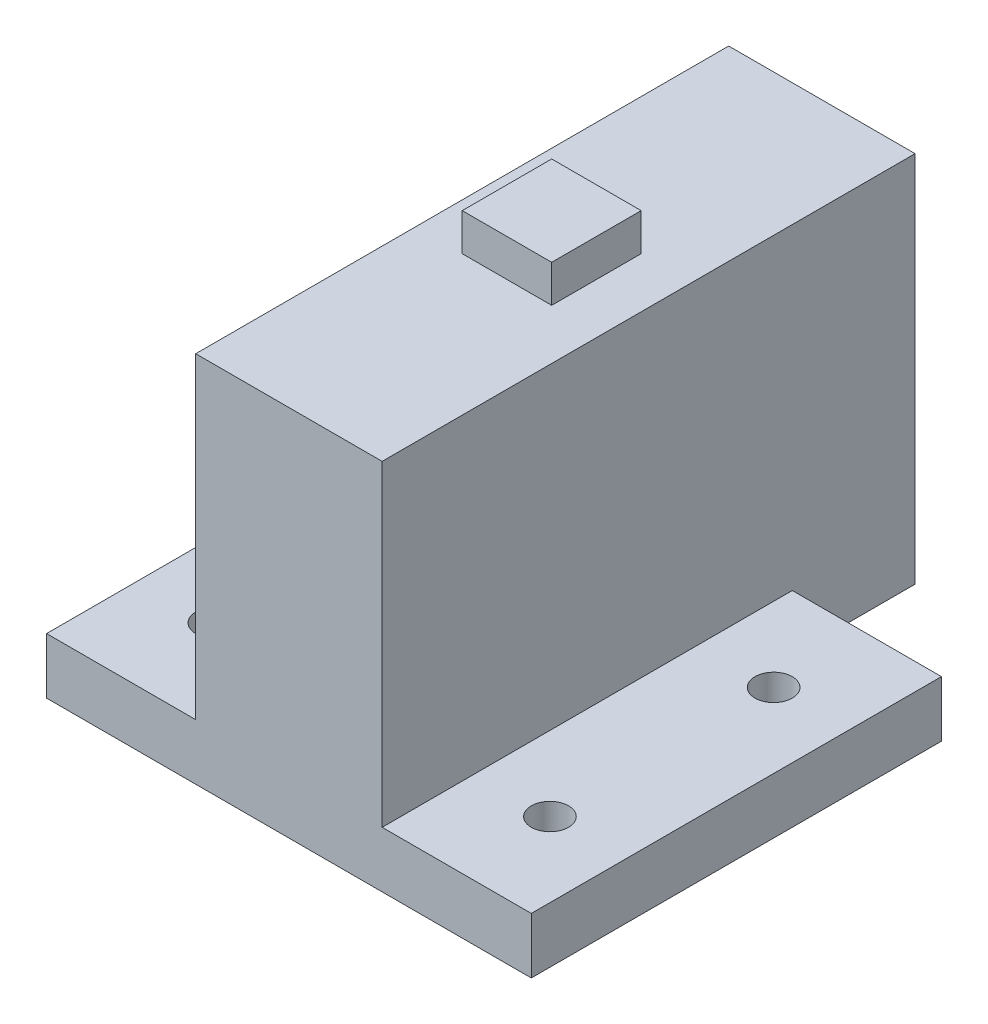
SolidWorks part; units mm, degrees
ref_plane "Front Plane" through (0, 0, 0) normal (0, 0, 1) x (1, 0, 0)
ref_plane "Top Plane" through (0, 0, 0) normal (0, 1, 0) x (1, 0, 0)
ref_plane "Right Plane" through (0, 0, 0) normal (1, 0, 0) x (0, 0, -1)
sketch "Sketch1" plane through (0, 0, 0) normal (0, 1, 0) x (1, 0, 0)
  line L2 (-20, 0) -> (-20, 150)
  line L4 (-20, 150) -> (30, 150)
  line L6 (-20, 0) -> (30, 0)
  line L7 (30, 150) -> (30, 0)
  dimension "D2" = 150
extrude "Boss-Extrude1" add sketch "Sketch1" along normal blind 250
sketch "Sketch2" plane through (30, 0, 0) normal (1, 0, 0) x (0, 0, -1)
  line L0 (75, 250) -> (75, 175) construction
  line L1 (0, 250) -> (150, 250) construction
  circle A0 centre (75, 175) radius 52.5
  dimension "D2" = 105
  dimension "D1" = 75
extrude "Cut-Extrude1" cut sketch "Sketch2" against normal blind 15 contours A0
sketch "Sketch4" plane through (0, 0, 0) normal (0, 0, 1) x (1, 0, 0)
  line L0 (30, 0) -> (30, 125) construction
  line L1 (30, 0) -> (30, 62.5)
  line L2 (30, 250) -> (30, 0) construction
  line L3 (30, 62.5) -> (-20, 62.5) construction
  line L4 (30, 0) -> (101.0377, 0)
  line L5 (-20, 250) -> (-20, 0) construction
  line L6 (-20, 0) -> (-91, 0)
  line L7 (-20, 0) -> (-20, 62.5)
  arc A0 (101.0377, 0) -> (30, 62.5) centre (101.0377, 71.6208) cw
  arc A1 (-91, 0) -> (-20, 62.5) centre (-91, 71.578) ccw
  dimension "D1" = 71.6208
  dimension "D2" = 71
extrude "Boss-Extrude2" add sketch "Sketch4" against normal up to vertex (150 mm away)
sketch "Sketch8" plane through (0, 0, -150) normal (0, 0, -1) x (-1, 0, 0)
  line L0 (-30, 250) -> (-30, 62.5)
  line L2 (20, 62.5) -> (20, 250)
  line L3 (20, 250) -> (-30, 250)
  line L4 (-101.0377, 0) -> (91, 0)
  arc A0 (-101.0377, 0) -> (-30, 62.5) centre (-101.0377, 71.6208) ccw
  arc A1 (91, 0) -> (20, 62.5) centre (91, 71.578) cw
extrude "Boss-Extrude3" add sketch "Sketch8" along normal blind 175
sketch "Sketch10" plane through (30, 0, 0) normal (1, 0, 0) x (0, 0, -1)
  line L0 (325, 250) -> (275.0118, 250)
  line L1 (0, 250) -> (325, 250) construction
  line L2 (275.0118, 250) -> (275.0118, 0)
  line L3 (325, 0) -> (0, 0) construction
  line L4 (275.0118, 0) -> (325, 0)
  line L5 (325, 0) -> (325, 250)
  dimension "D1" = 250
  dimension "D2" = 49.9882
extrude "Boss-Extrude4" add sketch "Sketch10" along normal blind 200
sketch "Sketch11" plane through (0, 0, -325) normal (0, 0, -1) x (-1, 0, 0)
  line L0 (-230, 0) -> (-230, 175) construction
  line L2 (-230, 0) -> (-230, 250) construction
  line L3 (-166.5, 175) -> (-135.5, 175)
  line L4 (-166.5, 175) -> (-197.5, 175)
  line L5 (-197.5, 175) -> (-197.5, 154)
  line L6 (-197.5, 154) -> (-135.5, 154)
  line L8 (-135.5, 154) -> (-135.5, 175)
  dimension "D1" = 175
  dimension "D2" = 31
  dimension "D3" = 31
  dimension "D4" = 63.5
  dimension "D5" = 175
  dimension "D6" = 21
extrude "Cut-Extrude4" cut sketch "Sketch11" against normal through all
sketch "Sketch12" plane through (0, 250, 0) normal (0, 1, 0) x (1, 0, 0)
  line L0 (30, 275.0118) -> (30, 325)
  line L1 (-20, 325) -> (230, 325) construction
  line L2 (30, 325) -> (230, 325)
  line L3 (230, 325) -> (230, 275.0118)
  line L4 (230, 275.0118) -> (30, 275.0118)
extrude "Cut-Extrude5" cut sketch "Sketch12" against normal blind 55
sketch "Sketch16" plane through (15, 0, 0) normal (1, 0, 0) x (0, 0, -1)
  line L0 (71.75, 180) -> (78.25, 180)
  line L2 (71.75, 170) -> (78.25, 170)
  spline S0 degree 2 poles (78.25, 170) (84.2851, 175) (78.25, 180) knots 0 0 0 1 1 1
  spline S1 degree 2 poles (71.75, 180) (66.058, 175) (71.75, 170) knots 0 0 0 1 1 1
  point P17 (75, 175)
  point P18 (75, 175)
  dimension "D1" = 6.5
  dimension "D2" = 6.5
  dimension "D3" = 10
extrude "Cut-Extrude8" cut sketch "Sketch16" against normal blind 20
sketch "Sketch17" plane through (15, 0, 0) normal (1, 0, 0) x (0, 0, -1)
  line L1 (81.3183, 180.25) -> (81.3183, 169.75)
  line L3 (68.8183, 169.75) -> (68.8183, 180.25)
  line L4 (68.8183, 169.75) -> (81.3183, 169.75)
  line L5 (68.8183, 180.25) -> (81.3183, 180.25)
  line L6 (78.25, 180) -> (71.75, 180) construction
  point P35 (69.975, 175)
  dimension "D2" = 10.5
  dimension "D3" = 12.5
  dimension "D4" = 0.25
extrude "Cut-Extrude9" cut sketch "Sketch17" against normal blind 9 contours L5 L3 L4 M3 | L5 L4 L1 M5
sketch "Sketch20" plane through (30, 0, 0) normal (1, 0, 0) x (0, 0, -1)
  circle A2 centre (75, 175) radius 54.5
  circle A3 centre (75, 175) radius 54.5
  dimension "D1" = 2
extrude "Cut-Extrude10" cut sketch "Sketch20" against normal blind 10
sketch "Sketch21" plane through (30, 0, 0) normal (1, 0, 0) x (0, 0, -1)
  line L0 (142.9431, 250) -> (142.9431, 195)
  line L1 (0, 250) -> (325, 250) construction
  line L2 (142.9431, 195) -> (325, 195)
  line L3 (325, 195) -> (325, 250) construction
  line L4 (325, 195) -> (325, 250)
  line L5 (142.9431, 250) -> (325, 250)
extrude "Cut-Extrude11" cut sketch "Sketch21" against normal through all
sketch "Sketch24" plane through (0, 0, -275.0118) normal (0, 0, 1) x (1, 0, 0)
  line L0 (158.25, 154) -> (158.25, 137.5)
  line L1 (158.25, 154) -> (174.75, 154)
  line L2 (174.75, 154) -> (174.75, 137.5)
  line L3 (174.75, 137.5) -> (158.25, 137.5)
  line L4 (197.5, 154) -> (135.5, 154) construction
  point P1 (166.5, 154)
  dimension "D1" = 16.5
  dimension "D2" = 16.5
  dimension "D3" = 8.25
  dimension "D4" = 0
extrude "Cut-Extrude13" cut sketch "Sketch24" against normal blind 50
sketch "Sketch25" plane through (0, 0, -275.0118) normal (0, 0, 1) x (1, 0, 0)
  line L0 (158.25, 131.1863) -> (174.75, 131.1863)
  line L1 (174.75, 131.1863) -> (174.75, 109.1863)
  line L2 (174.75, 109.1863) -> (158.25, 109.1863)
  line L3 (158.25, 109.1863) -> (158.25, 131.1863)
  line L4 (174.75, 137.5) -> (174.75, 154) construction
  line L5 (158.25, 137.5) -> (158.25, 86.1961) construction
  dimension "D1" = 0
  dimension "D2" = 0
  dimension "D3" = 22
extrude "Cut-Extrude14" cut sketch "Sketch25" against normal blind 50
sketch "Sketch26" plane through (0, 0, -275.0118) normal (0, 0, 1) x (1, 0, 0)
  line L0 (158.25, 137.5) -> (158.25, 131.1863)
  line L1 (174.75, 131.1863) -> (158.25, 131.1863) construction
  line L2 (158.25, 131.1863) -> (174.75, 131.1863)
  line L3 (174.75, 131.1863) -> (174.75, 137.5)
  line L4 (174.75, 137.5) -> (158.25, 137.5)
extrude "Cut-Extrude15" cut sketch "Sketch26" against normal blind 50
sketch "Sketch27" plane through (230, 0, 0) normal (1, 0, 0) x (0, 0, -1)
  line L0 (291.5012, 135.1004) -> (298.0012, 135.1004)
  line L2 (291.5012, 125.1004) -> (298.0012, 125.1004)
  spline S0 degree 2 poles (298.0012, 125.1004) (303.3445, 130.2078) (298.0012, 135.1004) knots 0 0 0 1 1 1
  spline S1 degree 2 poles (291.5012, 135.1004) (285.4561, 130.2078) (291.5012, 125.1004) knots 0 0 0 1 1 1
  point P5 (294.7512, 109.4204)
  point P17 (294.7512, 115.4204)
  point P18 (294.7512, 115.4204)
  dimension "D1" = 6.5
  dimension "D2" = 6.5
  dimension "D3" = 10
  dimension "D4" = 15.68
extrude "Cut-Extrude16" cut sketch "Sketch27" against normal blind 29 from offset 71.75
sketch "Sketch29" plane through (158.25, 0, 0) normal (1, 0, 0) x (0, 0, -1)
  line L0 (298.0012, 135.1004) -> (291.5012, 135.1004) construction
  line L1 (291.5012, 125.1004) -> (298.0012, 125.1004) construction
  line L2 (298.0012, 135.1004) -> (291.5012, 135.1004)
  line L3 (291.5012, 125.1004) -> (298.0012, 125.1004)
  line L4 (300.8323, 135.3999) -> (300.8323, 124.8999)
  line L5 (288.3323, 124.8999) -> (288.3323, 135.3999)
  line L6 (288.3323, 124.8999) -> (300.8323, 124.8999)
  line L7 (288.3323, 135.3999) -> (300.8323, 135.3999)
  parabola Q0 construction
  parabola Q1 construction
  parabola Q2
  parabola Q3
  dimension "D1" = 12.5
  dimension "D2" = 10.5
extrude "Cut-Extrude18" cut sketch "Sketch29" against normal blind 9
sketch "Sketch30" plane through (0, 0, -275.0118) normal (0, 0, 1) x (1, 0, 0)
  line L0 (158.25, 135.3999) -> (158.25, 124.8999) construction
  line L1 (158.25, 142.0296) -> (158.25, 109.1753)
  line L2 (158.25, 142.0296) -> (198.9228, 142.0296)
  line L3 (198.9228, 142.0296) -> (198.9228, 109.1753)
  line L4 (198.9228, 109.1753) -> (158.25, 109.1753)
extrude "Cut-Extrude19" cut sketch "Sketch30" against normal blind 50
sketch "Sketch31" plane through (-5, 0, 0) normal (1, 0, 0) x (0, 0, -1)
  circle A0 centre (74.9505, 175.0712) radius 3.5
  dimension "D1" = 7
extrude "Cut-Extrude20" cut sketch "Sketch31" against normal blind 20
sketch "Sketch32" plane through (0, 0, -325) normal (0, 0, -1) x (-1, 0, 0)
  line L4 (-129.25, 135.1004) -> (-149.25, 135.1004)
  line L5 (-149.25, 135.1004) -> (-149.25, 125.1004)
  line L6 (-149.25, 125.1004) -> (-129.25, 125.1004)
  line L7 (-129.25, 125.1004) -> (-129.25, 135.1004)
  line L8 (-129.25, 135.1004) -> (-149.25, 135.1004)
  line L9 (-149.25, 135.1004) -> (-149.25, 125.1004)
  line L10 (-149.25, 125.1004) -> (-129.25, 125.1004)
  line L11 (-129.25, 125.1004) -> (-129.25, 135.1004)
  circle A0 centre (-131.6164, 129.9902) radius 3.5
  dimension "D2" = 7
  dimension "D1" = 0
extrude "Cut-Extrude21" cut sketch "Sketch32" against normal blind 33 contours L11 A0
sketch "Sketch33" plane through (30, 0, 0) normal (1, 0, 0) x (0, 0, -1)
  circle A0 centre (74.9505, 175.0712) radius 60
  circle A1 centre (74.9505, 175.0712) radius 63
  dimension "D1" = 120
  dimension "D2" = 126
extrude "Cut-Extrude22" cut sketch "Sketch33" against normal blind 20
sketch "Sketch34" plane through (0, 195, 0) normal (0, 1, 0) x (1, 0, 0)
  line L0 (-91, 325) -> (230, 325)
  line L1 (230, 325) -> (230, 235)
  line L2 (230, 235) -> (-91, 235)
  line L3 (-91, 325) -> (-91, 0) construction
  line L4 (-91, 235) -> (-91, 325)
  dimension "D1" = 90
extrude "Cut-Extrude23" cut sketch "Sketch34" against normal blind 300
sketch "Sketch35" plane through (0, 250, 0) normal (0, 1, 0) x (1, 0, 0)
  line L0 (-91, 0) -> (-20, 0)
  line L1 (-20, 0) -> (-20, 235)
  line L2 (-20, 235) -> (-91, 235)
  line L3 (-91, 235) -> (-91, 0)
  line L4 (30, 0) -> (101.0377, 0)
  line L5 (101.0377, 0) -> (101.0377, 235)
  line L6 (101.0377, 235) -> (30, 235)
  line L7 (30, 235) -> (30, 0)
extrude "Cut-Extrude24" cut sketch "Sketch35" against normal through all both
sketch "Sketch36" plane through (0, 195, 0) normal (0, 1, 0) x (1, 0, 0)
  line L0 (30, 235) -> (80, 235)
  line L1 (80, 235) -> (80, 190)
  line L2 (80, 190) -> (30, 190)
  line L3 (30, 142.9431) -> (30, 235) construction
  line L4 (30, 190) -> (30, 235)
  dimension "D1" = 50
  dimension "D2" = 45
extrude "Boss-Extrude5" add sketch "Sketch36" against normal blind 40 from offset 155
sketch "Sketch38" plane through (30, 0, 0) normal (1, 0, 0) x (0, 0, -1)
  line L0 (0, 0) -> (0, 15)
  line L1 (0, 250) -> (0, 0) construction
  line L2 (0, 15) -> (110, 15)
  line L3 (110, 15) -> (110, 0)
  line L5 (110, 0) -> (0, 0)
  dimension "D1" = 110
  dimension "D2" = 110
  dimension "D3" = 15
extrude "Boss-Extrude6" add sketch "Sketch38" along normal blind 40
sketch "Sketch39" plane through (-20, 0, 0) normal (-1, 0, 0) x (0, 0, 1)
  line L0 (-110, 0) -> (-110, 15)
  line L1 (0, 0) -> (-235, 0) construction
  line L2 (-110, 15) -> (0, 15)
  line L3 (0, 250) -> (0, 0) construction
  line L4 (0, 15) -> (0, 0)
  line L5 (0, 0) -> (-110, 0)
  dimension "D1" = 110
  dimension "D2" = 15
extrude "Boss-Extrude7" add sketch "Sketch39" along normal blind 40
sketch "Sketch40" plane through (0, 15, 0) normal (0, 1, 0) x (1, 0, 0)
  line L0 (70, 0) -> (30, 0) construction
  line L1 (-60, 0) -> (-20, 0) construction
  line L2 (-60, 0) -> (-60, 110) construction
  line L3 (70, 110) -> (70, 0) construction
  circle A0 centre (-40, 85) radius 5
  circle A1 centre (-40, 25) radius 5
  circle A2 centre (50, 85) radius 5
  circle A3 centre (50, 25) radius 5
  dimension "D1" = 10
  dimension "D2" = 10
  dimension "D3" = 10
  dimension "D4" = 10
  dimension "D5" = 60
  dimension "D6" = 25
  dimension "D7" = 60
  dimension "D8" = 25
  dimension "D9" = 20
  dimension "D10" = 20
extrude "Cut-Extrude25" cut sketch "Sketch40" against normal through all both
sketch "Sketch41" plane through (0, 0, -235) normal (0, 0, -1) x (-1, 0, 0)
  line L0 (-15.075, 162.075) -> (-15.075, 141.925)
  line L1 (-15.075, 141.925) -> (5.075, 141.925)
  line L2 (5.075, 141.925) -> (5.075, 162.075)
  line L3 (5.075, 162.075) -> (-15.075, 162.075)
  line L4 (-15.075, 109.075) -> (-15.075, 88.925)
  line L5 (-15.075, 88.925) -> (5.075, 88.925)
  line L6 (5.075, 88.925) -> (5.075, 109.075)
  line L7 (5.075, 109.075) -> (-15.075, 109.075)
  line L8 (-15.075, 56.075) -> (-15.075, 35.925)
  line L9 (-15.075, 35.925) -> (5.075, 35.925)
  line L10 (5.075, 35.925) -> (5.075, 56.075)
  line L11 (5.075, 56.075) -> (-15.075, 56.075)
  line L12 (-62.075, 30.075) -> (-62.075, 9.925)
  line L13 (-62.075, 9.925) -> (-41.925, 9.925)
  line L14 (-41.925, 9.925) -> (-41.925, 30.075)
  line L15 (-41.925, 30.075) -> (-62.075, 30.075)
  line L16 (-15.075, 162.075) -> (5.075, 141.925) construction
  line L17 (5.075, 162.075) -> (-15.075, 141.925) construction
  line L18 (-15.075, 109.075) -> (5.075, 88.925) construction
  line L19 (5.075, 109.075) -> (-15.075, 88.925) construction
  line L20 (-15.075, 56.075) -> (5.075, 35.925) construction
  line L21 (5.075, 56.075) -> (-15.075, 35.925) construction
  line L22 (-62.075, 30.075) -> (-41.925, 9.925) construction
  line L23 (-41.925, 30.075) -> (-62.075, 9.925) construction
  line L24 (20, 195) -> (-30, 195) construction
  line L25 (-80, 0) -> (-80, 40) construction
  line L26 (-80, 40) -> (-30, 40) construction
  line L27 (-30, 40) -> (-30, 195) construction
  point P16 (-52, 20)
  point P17 (-5, 46)
  point P18 (-5, 99)
  point P19 (-5, 152)
  dimension "D1" = 20.15
  dimension "D2" = 20.15
  dimension "D3" = 20.15
  dimension "D4" = 20.15
  dimension "D5" = 20.15
  dimension "D6" = 20.15
  dimension "D7" = 20.15
  dimension "D8" = 20.15
  dimension "D9" = 43
  dimension "D10" = 96
  dimension "D11" = 149
  dimension "D12" = 28
  dimension "D13" = 20
  dimension "D14" = 25
  dimension "D15" = 25
  dimension "D16" = 25
extrude "Cut-Extrude26" cut sketch "Sketch41" against normal blind 31.5
sketch "Sketch43" plane through (30, 0, 0) normal (1, 0, 0) x (0, 0, -1)
  line L1 (142.9431, 195) -> (235, 195)
  line L2 (142.9431, 195) -> (142.9431, 0)
  line L3 (142.9431, 0) -> (235, 0)
  line L4 (235, 195) -> (235, 0)
extrude "Cut-Extrude27" cut sketch "Sketch43" against normal blind 70 and the other way blind 75 contours L2 L1 L4 L3
sketch "Sketch44" plane through (30, 0, 0) normal (1, 0, 0) x (0, 0, -1)
  line L0 (0, 250) -> (0, 15) construction
  line L6 (142.9431, 100) -> (0, 100)
  line L7 (142.9431, 100) -> (142.9431, 250)
  line L8 (142.9431, 250) -> (0, 250)
  line L9 (0, 100) -> (0, 250)
extrude "Cut-Extrude28" cut sketch "Sketch44" against normal blind 62 and the other way blind 41
sketch "Sketch45" plane through (0, 100, 0) normal (0, 1, 0) x (1, 0, 0)
  line L4 (-7.5, 58.9716) -> (16.5, 58.9716)
  line L5 (-7.5, 58.9716) -> (-7.5, 82.9716)
  line L6 (-7.5, 82.9716) -> (16.5, 82.9716)
  line L7 (16.5, 58.9716) -> (16.5, 82.9716)
  line L8 (-7.5, 58.9716) -> (5, 71.4731) construction
  line L9 (5, 71.4731) -> (16.5, 58.9716) construction
  line L12 (30, 142.9431) -> (-20, 142.9431) construction
  line L13 (30, 0) -> (30, 142.9431) construction
  line L14 (-20, 142.9431) -> (-20, 0) construction
  line L16 (30, 0) -> (-20, 0) construction
  line L17 (30, 110) -> (30, 0) construction
  point P4 (0, 0)
  point P6 (0.1269, 88.3244)
  dimension "D1" = 24
  dimension "D2" = 24
  dimension "D3" = 71.47
  dimension "D4" = 25
  dimension "D5" = 25
  dimension "D6" = 58.9716
  dimension "D7" = 13.5
extrude "Boss-Extrude8" add sketch "Sketch45" along normal blind 10
sketch "Sketch46" plane through (0, 0, -142.9431) normal (0, 0, -1) x (-1, 0, 0)
  line L4 (-17.5, 37.5) -> (7.5, 37.5)
  line L5 (-17.5, 37.5) -> (-17.5, 62.5)
  line L6 (-17.5, 62.5) -> (7.5, 62.5)
  line L7 (7.5, 37.5) -> (7.5, 62.5)
  line L8 (-17.5, 37.5) -> (7.5, 62.5) construction
  line L9 (-17.5, 62.5) -> (7.5, 37.5) construction
  point P6 (-5, 50)
  dimension "D1" = 25
  dimension "D2" = 25
extrude "Cut-Extrude29" cut sketch "Sketch46" against normal blind 10
